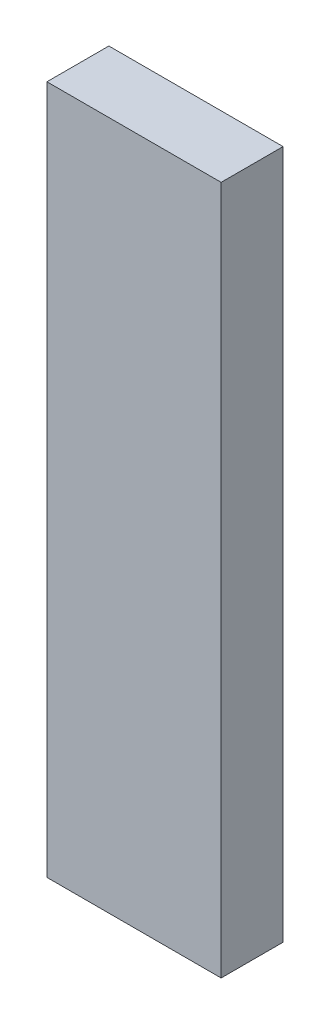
SolidWorks part; units mm, degrees
ref_plane "Plan de face" through (0, 0, 0) normal (0, 0, 1) x (1, 0, 0)
ref_plane "Plan de dessus" through (0, 0, 0) normal (0, 1, 0) x (1, 0, 0)
ref_plane "Plan de droite" through (0, 0, 0) normal (1, 0, 0) x (0, 0, -1)
sketch "Esquisse1" plane through (0, 0, 0) normal (0, 0, 1) x (1, 0, 0)
  line L1 (0, 0) -> (22.5, 0)
  line L2 (0, 0) -> (0, 89)
  line L3 (0, 89) -> (22.5, 89)
  line L4 (22.5, 0) -> (22.5, 89)
  dimension "D1" = 22.5
  dimension "D2" = 89
extrude "Extrusion1" add sketch "Esquisse1" along normal blind 8
